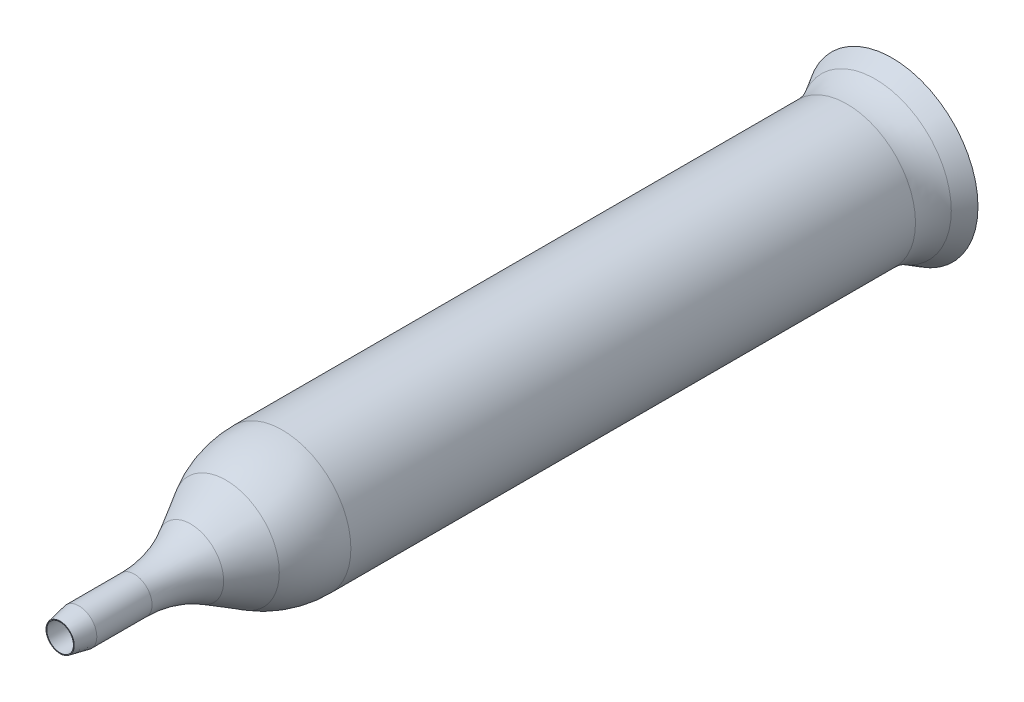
SolidWorks part; units mm, degrees
ref_plane "Front Plane" through (0, 0, 0) normal (0, 0, 1) x (1, 0, 0)
ref_plane "Top Plane" through (0, 0, 0) normal (0, 1, 0) x (1, 0, 0)
ref_plane "Right Plane" through (0, 0, 0) normal (1, 0, 0) x (0, 0, -1)
sketch "Sketch3" plane through (0, 0, 0) normal (1, 0, 0) x (0, 0, -1)
  line L0 (0, 0) -> (50000, 0) construction
  line L1 (0, 0) -> (0, 50000) construction
  line L2 (74.4329, 17) -> (-74.4329, 17)
  line L3 (-89.4329, 12.9808) -> (-98.8059, 7.5692)
  line L4 (-113.8059, 3.55) -> (-133.8059, 3.55)
  line L8 (75.2456, 18.2) -> (-74.7544, 18.2)
  line L9 (-89.7544, 14.1808) -> (-99.1274, 8.7692)
  line L10 (-114.1274, 4.75) -> (-133.8059, 4.75)
  line L12 (-133.8059, 3.55) -> (-133.8059, 4.75)
  line L13 (79.2648, 17) -> (-82.4713, 17) construction
  line L14 (-82.4713, 17) -> (-105.7674, 3.55) construction
  line L15 (79.2648, 18.2) -> (-82.7929, 18.2) construction
  line L16 (-82.7929, 18.2) -> (-106.089, 4.75) construction
  line L17 (-106.089, 4.75) -> (-133.8059, 4.75) construction
  line L18 (-105.7674, 3.55) -> (-133.8059, 3.55) construction
  line L19 (81.9329, 19.0096) -> (87.562, 22.2596)
  line L20 (82.7456, 20.2096) -> (87.2456, 22.8077)
  line L21 (87.2456, 22.8077) -> (87.562, 22.2596)
  arc A0 (-74.4329, 17) -> (-89.4329, 12.9808) centre (-74.4329, -13) ccw
  arc A1 (-74.7544, 18.2) -> (-89.7544, 14.1808) centre (-74.7544, -11.8) ccw
  arc A2 (-99.1274, 8.7692) -> (-114.1274, 4.75) centre (-114.1274, 34.75) cw
  arc A3 (-98.8059, 7.5692) -> (-113.8059, 3.55) centre (-113.8059, 33.55) cw
  arc A4 (74.4329, 17) -> (81.9329, 19.0096) centre (74.4329, 32) ccw
  arc A5 (75.2456, 18.2) -> (82.7456, 20.2096) centre (75.2456, 33.2) ccw
  point P13 (0, 17)
  point P17 (-82.4713, 17)
  dimension "D7" = 30
  dimension "D2" = 15
  dimension "D1" = 30
  dimension "D3" = 1.2
  dimension "D4" = 9.5
  dimension "D5" = 34
  dimension "D6" = 20
  dimension "D8" = 30
  dimension "D9" = 6.5
  dimension "D10" = 150
  dimension "D11" = 12
revolve "Revolve1" add sketch "Sketch3" angle 360 about L0
chamfer "Chamfer1" distance 5 distance2 1 1 edges at (4.75, 0, 133.8059)
